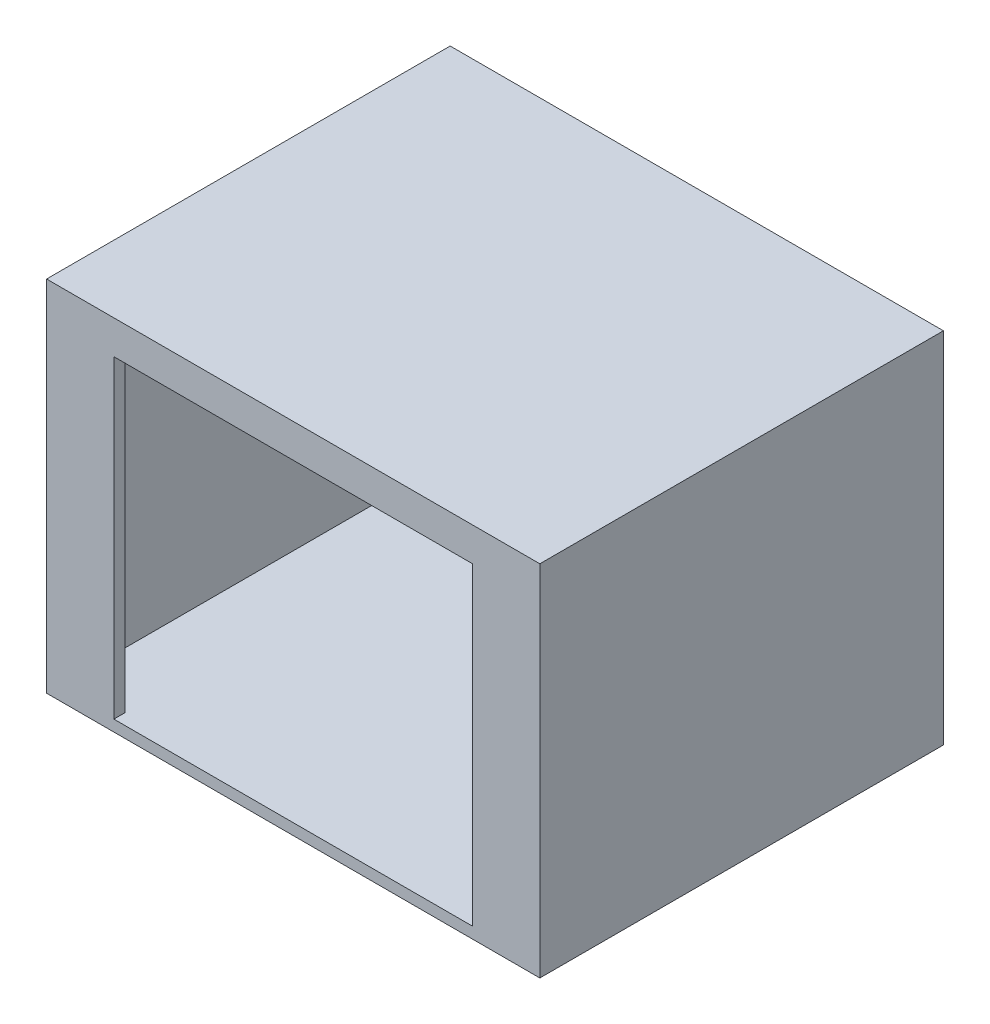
SolidWorks part; units mm, degrees
ref_plane "Front Plane" through (0, 0, 0) normal (0, 0, 1) x (1, 0, 0)
ref_plane "Top Plane" through (0, 0, 0) normal (0, 1, 0) x (1, 0, 0)
ref_plane "Right Plane" through (0, 0, 0) normal (1, 0, 0) x (0, 0, -1)
sketch "Sketch1" plane through (0, 0, 0) normal (0, 1, 0) x (1, 0, 0)
  line L1 (-279.4, 0) -> (279.4, 0)
  line L2 (-279.4, 0) -> (-279.4, 457.2)
  line L3 (-279.4, 457.2) -> (279.4, 457.2)
  line L4 (279.4, 0) -> (279.4, 457.2)
  dimension "D1" = 558.8
  dimension "D2" = 457.2
extrude "Extrude1" add sketch "Sketch1" along normal blind 406.4
shell "Shell1" thickness 12.7
sketch "Sketch2" plane through (0, 0, 0) normal (0, 0, 1) x (1, 0, 0)
  line L0 (-266.7, 12.7) -> (266.7, 12.7) construction
  line L1 (-203.2, 12.7) -> (203.2, 12.7)
  line L2 (-203.2, 12.7) -> (-203.2, 368.3)
  line L3 (-203.2, 368.3) -> (203.2, 368.3)
  line L4 (203.2, 12.7) -> (203.2, 368.3)
  line L5 (0, 393.7) -> (0, 368.3) construction
  line L6 (-266.7, 393.7) -> (266.7, 393.7) construction
  dimension "D1" = 355.6
  dimension "D2" = 406.4
extrude "Cut-Extrude1" cut sketch "Sketch2" against normal up to next
